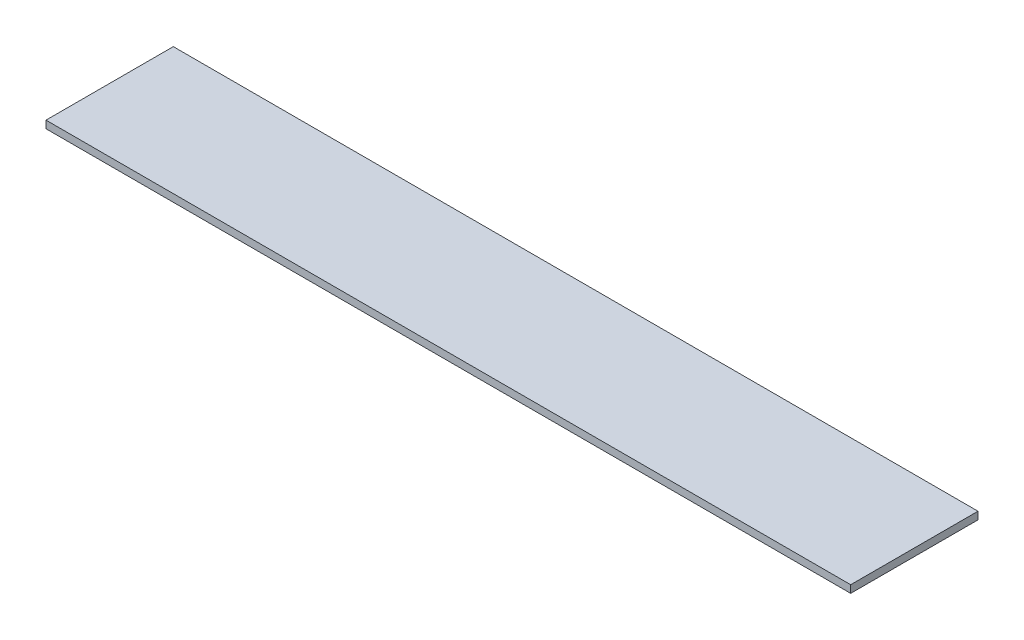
SolidWorks part; units mm, degrees
ref_plane "Front" through (0, 0, 0) normal (0, 0, 1) x (1, 0, 0)
ref_plane "Top" through (0, 0, 0) normal (0, 1, 0) x (1, 0, 0)
ref_plane "Right" through (0, 0, 0) normal (1, 0, 0) x (0, 0, -1)
sketch "Sketch1" plane through (0, 0, 0) normal (0, 0, 1) x (1, 0, 0)
  line L1 (-209.8261, 67.8385) -> (-39.6461, 67.8385)
  line L2 (-209.8261, 67.8385) -> (-209.8261, 43.4545)
  line L3 (-209.8261, 43.4545) -> (-39.6461, 43.4545)
  line L4 (-39.6461, 67.8385) -> (-39.6461, 43.4545)
  dimension "D1" = 170.18
  dimension "D2" = 24.384
extrude "Boss-Extrude1" add sketch "Sketch1" along normal blind 26.924
sketch "Sketch2" plane through (0, 67.8385, 0) normal (0, 1, 0) x (1, 0, 0)
  line L0 (-209.8261, -26.924) -> (-209.8261, 0) construction
  line L1 (-209.8261, -1.5875) -> (-39.6461, -1.5875)
  line L2 (-209.8261, -1.5875) -> (-209.8261, -26.924)
  line L3 (-209.8261, -26.924) -> (-39.6461, -26.924)
  line L4 (-39.6461, -1.5875) -> (-39.6461, -26.924)
  line L5 (-39.6461, 0) -> (-209.8261, 0) construction
  dimension "D1" = 1.5875
extrude "Cut-Extrude1" cut sketch "Sketch2" against normal blind 12.7
sketch "Sketch3" plane through (0, 0, 26.924) normal (0, 0, 1) x (1, 0, 0)
  line L0 (-39.6461, 43.4545) -> (-39.6461, 55.1385) construction
  line L1 (-209.8261, 55.1385) -> (-39.6461, 55.1385)
  line L2 (-209.8261, 55.1385) -> (-209.8261, 45.042)
  line L3 (-209.8261, 45.042) -> (-39.6461, 45.042)
  line L4 (-39.6461, 55.1385) -> (-39.6461, 45.042)
  line L5 (-209.8261, 43.4545) -> (-39.6461, 43.4545) construction
  dimension "D1" = 1.5875
extrude "Cut-Extrude3" cut sketch "Sketch3" against normal up to surface (25.3365 mm away)
sketch "Sketch5" plane through (0, 0, 0) normal (0, 0, -1) x (-1, 0, 0)
  line L0 (6.6261, 77.4225) -> (6.6261, -19.794) construction
  line L1 (39.6461, 67.8385) -> (209.8261, 67.8385) construction
  line L2 (39.6461, 43.4545) -> (39.6461, 67.8385) construction
  circle A0 centre (52.3461, 55.1385) radius 2.032
  circle A1 centre (-39.0939, 55.1385) radius 2.032
  dimension "D3" = 4.064
  dimension "D1" = 12.7
  dimension "D2" = 12.7
extrude "Cut-Extrude5" cut sketch "Sketch5" against normal blind 2.54
sketch "Sketch6" plane through (0, 0, 1.5875) normal (0, 0, 1) x (1, 0, 0)
  line L1 (-209.8261, 45.042) -> (268.6822, 45.042)
  line L2 (-209.8261, 45.042) -> (-209.8261, 129.5455)
  line L3 (-209.8261, 129.5455) -> (268.6822, 129.5455)
  line L4 (268.6822, 45.042) -> (268.6822, 129.5455)
extrude "Cut-Extrude6" cut sketch "Sketch6" against normal blind 2.54
equation "\".5n\"=1"
